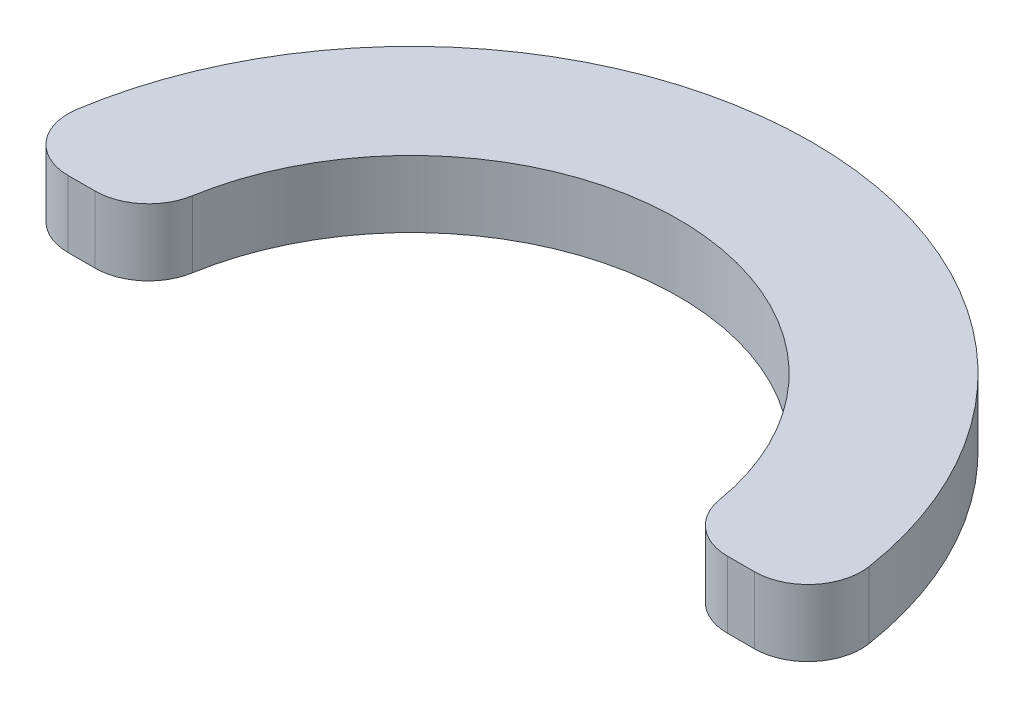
SolidWorks part; units mm, degrees
ref_plane "X-Y Datum" through (0, 0, 0) normal (0, 0, 1) x (1, 0, 0)
ref_plane "X-Z Datum" through (0, 0, 0) normal (0, 1, 0) x (1, 0, 0)
ref_plane "Y-Z Datum" through (0, 0, 0) normal (1, 0, 0) x (0, 0, -1)
sketch "Sketch1" plane through (0, 0, 0) normal (0, 1, 0) x (1, 0, 0)
  line L0 (-12.7, 0) -> (-19.05, 0)
  line L1 (12.7, 0) -> (19.05, 0)
  arc A0 (12.7, 0) -> (-12.7, 0) centre (0, 0) ccw
  arc A1 (19.05, 0) -> (-19.05, 0) centre (0, 0) ccw
  point P6 (0, 12.7)
  dimension "D1" = 25.4
  dimension "D2" = 38.1
extrude "Boss-Extrude1" add sketch "Sketch1" along normal blind 3.175
fillet "Fillet1" radius 2.54 4 edges at (-19.05, 1.5875, 0) (-12.7, 1.5875, 0) (12.7, 1.5875, 0) (19.05, 1.5875, 0)
